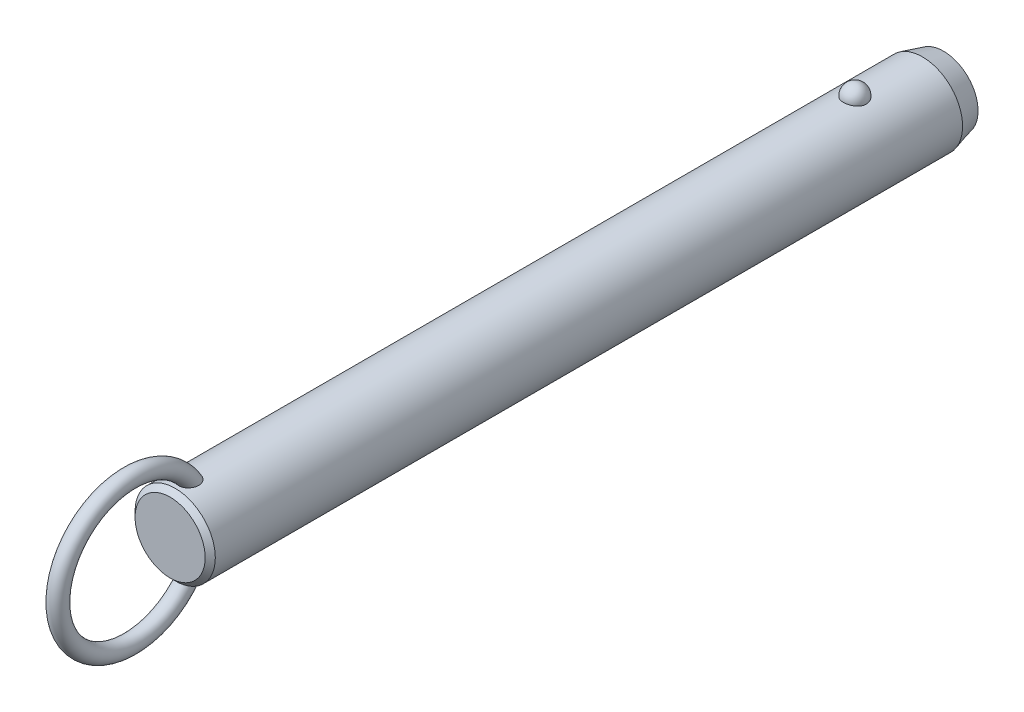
SolidWorks part; units mm, degrees
ref_plane "Front Plane" through (0, 0, 0) normal (0, 0, 1) x (1, 0, 0)
ref_plane "Top Plane" through (0, 0, 0) normal (0, 1, 0) x (1, 0, 0)
ref_plane "Right Plane" through (0, 0, 0) normal (1, 0, 0) x (0, 0, -1)
sketch "Sketch2" plane through (0, 0, 0) normal (0, 0, 1) x (1, 0, 0)
  circle A0 centre (0, 0) radius 9.5
  point P3 (0, 9.5)
  dimension "D1" = 19
extrude "Boss-Extrude1" add sketch "Sketch2" along normal blind 149.9
sketch "Sketch3" plane through (0, 0, 0) normal (0, 0, -1) x (-1, 0, 0)
  circle A0 centre (0, 0) radius 9.5
  dimension "D1" = 19
extrude "Boss-Extrude2" add sketch "Sketch3" along normal blind 23.7
chamfer "Chamfer1" distance 5 angle 15 1 edges at (-9.5, 0, -23.7)
sketch "Sketch12" plane through (0, 0, 0) normal (1, 0, 0) x (0, 0, -1)
  line L0 (-149.9, 9.5) -> (-149.9, -9.5) construction
  point P0 (-149.9, 0)
sketch "Sketch13" plane through (0, 0, 0) normal (1, 0, 0) x (0, 0, -1)
  circle A0 centre (-168.95, 0) radius 19.05
  point P2 (-149.9, 0)
  dimension "D1" = 38.1
sketch "Sketch14" plane through (0, 0, 0) normal (0, 1, 0) x (1, 0, 0)
  circle A0 centre (0, -151.9) radius 2
  point P2 (0, -149.9)
  dimension "D1" = 4
sweep "Sweep1" add profiles "Sketch14" path "Sketch13"
sketch "Sketch15" plane through (0, 0, 149.9) normal (0, 0, 1) x (1, 0, 0)
  circle A0 centre (0, 0) radius 9.5
  dimension "D1" = 19
extrude "Boss-Extrude3" add sketch "Sketch15" along normal blind 9.52
chamfer "Chamfer2" distance 1.2 angle 45 1 edges at (9.5, 0, 159.42)
sketch "Sketch18" plane through (0, 0, 0) normal (1, 0, 0) x (0, 0, -1)
  line L0 (18.7, 9.5) -> (-152.4378, 9.5) construction
  line L1 (2.7, 12.2) -> (2.7, 6.8)
  line L2 (-152.4378, -9.5) -> (18.7, -9.5) construction
  arc A0 (2.7, 12.2) -> (2.7, 6.8) centre (2.7, 9.5) ccw
  point P4 (0, 9.5)
  dimension "D1" = 21.7
revolve "Revolve1" add sketch "Sketch18" angle 360 about L1
